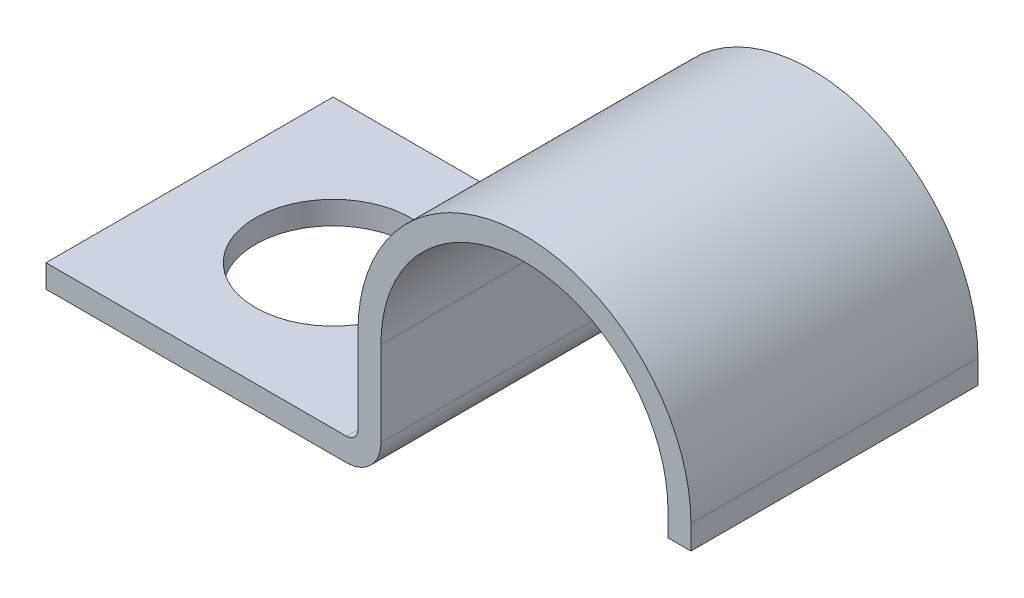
SolidWorks part; units mm, degrees
ref_plane "Front Plane" through (0, 0, 0) normal (0, 0, 1) x (1, 0, 0)
ref_plane "Top Plane" through (0, 0, 0) normal (0, 1, 0) x (1, 0, 0)
ref_plane "Right Plane" through (0, 0, 0) normal (1, 0, 0) x (0, 0, -1)
sketch "Sketch1" plane through (0, 0, 0) normal (0, 0, 1) x (1, 0, 0)
  line L0 (0, 0) -> (19.939, 0)
  line L1 (22.225, 2.286) -> (22.225, 7.9248)
  line L2 (41.275, 7.9248) -> (41.275, 6.35)
  arc A0 (22.225, 7.9248) -> (41.275, 7.9248) centre (31.75, 7.9248) cw
  arc A1 (19.939, 0) -> (22.225, 2.286) centre (19.939, 2.286) ccw
  point P9 (31.75, 17.4498)
extrude "Extrude-Thin1" add sketch "Sketch1" along normal mid plane 19.05 thin
sketch "Sketch2" plane through (0, 1.524, 0) normal (0, 1, 0) x (1, 0, 0)
  line L0 (0, -9.525) -> (0, 9.525) construction
  line L2 (0, 0) -> (144.0418, 0) construction
  circle A0 centre (9.525, 0) radius 5.1562
  dimension "D1" = 10.3124
  dimension "D2" = 9.525
extrude "Cut-Extrude1" cut sketch "Sketch2" against normal up to surface (1.524 mm away)
equation "\"D1@Sketch1\" = 1.5 * \"D5@Extrude-Thin1\""
